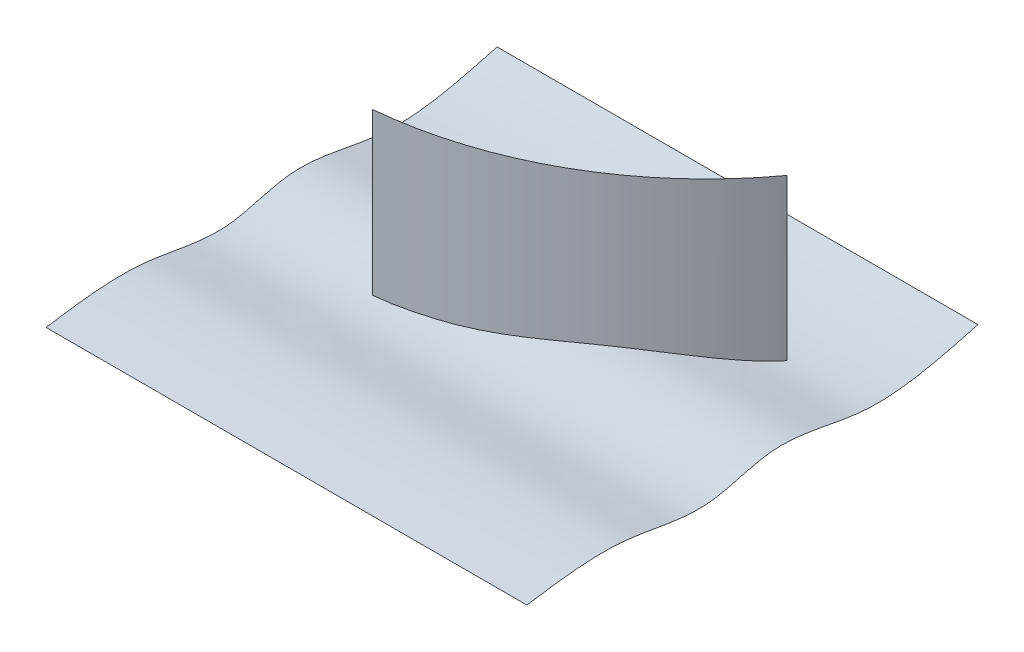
SolidWorks part; units mm, degrees
ref_plane "Front Plane" through (0, 0, 0) normal (0, 0, 1) x (1, 0, 0)
ref_plane "Top Plane" through (0, 0, 0) normal (0, 1, 0) x (1, 0, 0)
ref_plane "Right Plane" through (0, 0, 0) normal (1, 0, 0) x (0, 0, -1)
sketch "Sketch1" plane through (0, 0, 0) normal (0, 1, 0) x (1, 0, 0)
  arc A0 (83.0163, 70.4462) -> (-55.5131, -8.1899) centre (-73.1858, 184.2816) cw
surface "Surface-Extrude1" sketch "Sketch1" parameters "D1"=177.292
sketch "Sketch2" plane through (0, 0, 0) normal (1, 0, 0) x (0, 0, -1)
  spline S0 degree 3 poles (-108.6487, 4.8304) (-91.5274, 7.4101) (-59.3414, 12.2596) (-16.5747, -1.2447) (24.0687, 15.8694) (71.3504, -1.1643) (107.543, 8.5662) (127.4801, 13.9263) knots 0 0 0 0 0.216392 0.40679 0.537283 0.745106 1 1 1 1
surface "Surface-Extrude2" sketch "Sketch2" parameters "D1"=251.714
surface "Surface-Trim1"
